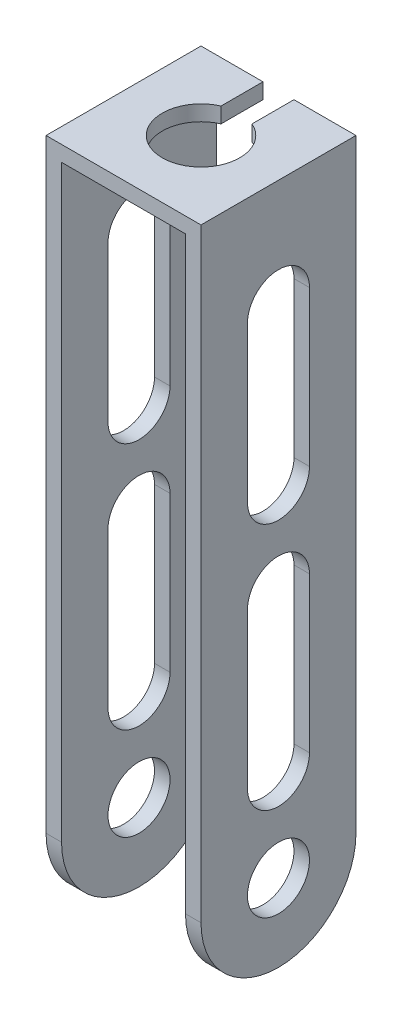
SolidWorks part; units mm, degrees
ref_plane "Piano frontale" through (0, 0, 0) normal (0, 0, 1) x (1, 0, 0)
ref_plane "Piano superiore" through (0, 0, 0) normal (0, 1, 0) x (1, 0, 0)
ref_plane "Piano destro" through (0, 0, 0) normal (1, 0, 0) x (0, 0, -1)
sketch "Schizzo1" plane through (0, 0, 0) normal (0, 0, 1) x (1, 0, 0)
  line L0 (-4, 43) -> (-4, 0)
  line L1 (-4, 43) -> (4, 43)
  line L2 (4, 43) -> (4, 0)
  line L3 (5, 44) -> (5, 0)
  line L4 (-5, 44) -> (5, 44)
  line L5 (-5, 44) -> (-5, 0)
  line L6 (-5, 0) -> (-4, 0)
  line L7 (4, 0) -> (5, 0)
  dimension "D1" = 8
  dimension "D2" = 4
  dimension "D3" = 43
  dimension "D4" = 1
extrude "Estrusione1" add sketch "Schizzo1" against normal blind 10
fillet "Raccordo1" radius 5 4 edges at (4.5, 0, -10) (-4.5, 0, -10) (-4.5, 0, 0) (4.5, 0, 0)
sketch "Schizzo2" plane through (-5, 0, 0) normal (-1, 0, 0) x (0, 0, 1)
  line L0 (-7, 21) -> (-7, 11)
  line L1 (-3, 21) -> (-3, 11)
  line L2 (-21.6452, 24) -> (13.668, 24) construction
  line L3 (-3, 27) -> (-3, 37)
  line L4 (-7, 27) -> (-7, 37)
  circle A0 centre (-5, 5) radius 2
  arc A1 (-7, 11) -> (-3, 11) centre (-5, 11) ccw
  arc A2 (-3, 21) -> (-7, 21) centre (-5, 21) ccw
  arc A3 (-3, 27) -> (-7, 27) centre (-5, 27) cw
  arc A4 (-7, 37) -> (-3, 37) centre (-5, 37) cw
  dimension "D1" = 4
  dimension "D2" = 4
  dimension "D3" = 4
  dimension "D4" = 10
  dimension "D5" = 6
  dimension "D6" = 3
extrude "Taglio-Estrusione1" cut sketch "Schizzo2" against normal through all
sketch "Schizzo3" plane through (0, 44, 0) normal (0, 1, 0) x (-1, 0, 0)
  line L1 (-1, -12.0122) -> (1, -12.0122)
  line L2 (-1, -12.0122) -> (-1, -7.2913)
  line L4 (1, -12.0122) -> (1, -7.2913)
  arc A0 (1, -7.2913) -> (-1, -7.2913) centre (0, -5) ccw
  dimension "D1" = 5
  dimension "D2" = 2
extrude "Taglio-Estrusione2" cut sketch "Schizzo3" against normal blind 10
